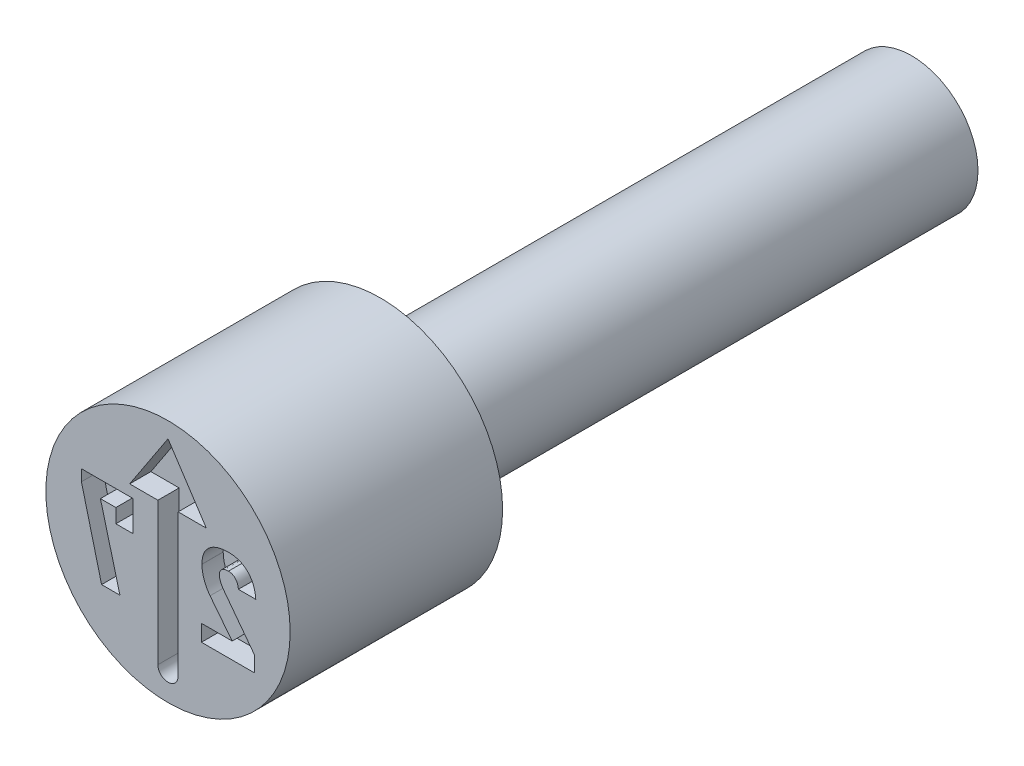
SolidWorks part; units mm, degrees
ref_plane "Front Plane" through (0, 0, 0) normal (0, 0, 1) x (1, 0, 0)
ref_plane "Top Plane" through (0, 0, 0) normal (0, 1, 0) x (1, 0, 0)
ref_plane "Right Plane" through (0, 0, 0) normal (1, 0, 0) x (0, 0, -1)
sketch "Sketch2" plane through (0, 0, 0) normal (1, 0, 0) x (0, 0, -1)
  line L0 (0.4039, 0) -> (50000.4039, 0) construction
  line L6 (0, 2.3) -> (0, 0)
  line L7 (4, 2.3) -> (0, 2.3)
  line L8 (4, 1.25) -> (4, 2.3)
  line L9 (14, 1.25) -> (4, 1.25)
  line L10 (14, 0) -> (14, 1.25)
  line L11 (0, 0) -> (14, 0)
  dimension "D1" = 4.6
  dimension "D2" = 2.5
  dimension "D3" = 14
  dimension "D4" = 4
revolve "Revolve1" add sketch "Sketch2" angle 360 about L0
sketch "Sketch3" plane through (0, 0, 0) normal (0, 0, 1) x (1, 0, 0)
  line L0 (0, 0) -> (0, 100000) construction
  line L1 (0.1905, 0.9064) -> (0.1905, -1.7762)
  line L2 (0.7219, 0.9064) -> (0.1905, 0.9064)
  line L3 (0, 2.0021) -> (0.7219, 0.9064)
  line L15 (0, 2.0021) -> (-0.7219, 0.9064)
  line L16 (-0.7219, 0.9064) -> (-0.1905, 0.9064)
  line L17 (-0.1905, 0.9064) -> (-0.1905, -1.7762)
  arc A2 (-0.1905, -1.7762) -> (0.1905, -1.7762) centre (0, -1.7762) ccw
extrude "Cut-Extrude4" cut sketch "Sketch3" against normal blind 0.4
sketch "Sketch4" plane through (0, 0, 0) normal (0, 0, 1) x (1, 0, 0)
  text T0 "2  7" font "Bahnschrift" height 1.7
  dimension "D1" = 1
extrude "Cut-Extrude5" cut sketch "Sketch4" against normal blind 0.4
